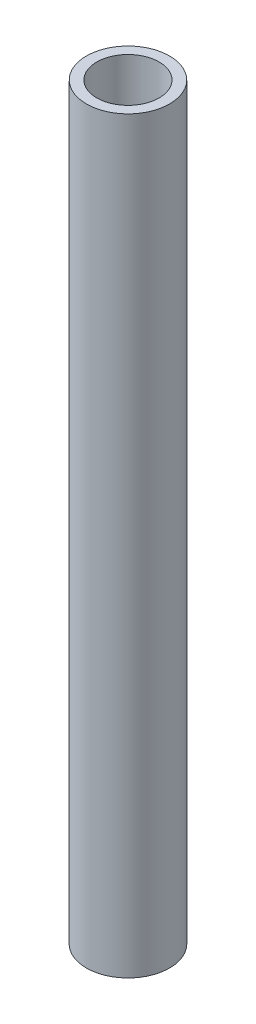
SolidWorks part; units mm, degrees
ref_plane "Front Plane" through (0, 0, 0) normal (0, 0, 1) x (1, 0, 0)
ref_plane "Top Plane" through (0, 0, 0) normal (0, 1, 0) x (1, 0, 0)
ref_plane "Right Plane" through (0, 0, 0) normal (1, 0, 0) x (0, 0, -1)
sketch "Sketch2" plane through (0, 0, 0) normal (0, 1, 0) x (1, 0, 0)
  circle A0 centre (0, 0) radius 25.4
  circle A1 centre (0, 0) radius 19.05
  dimension "D1" = 38.1
  dimension "D2" = 50.8
extrude "Boss-Extrude1" add sketch "Sketch2" along normal blind 457.2
